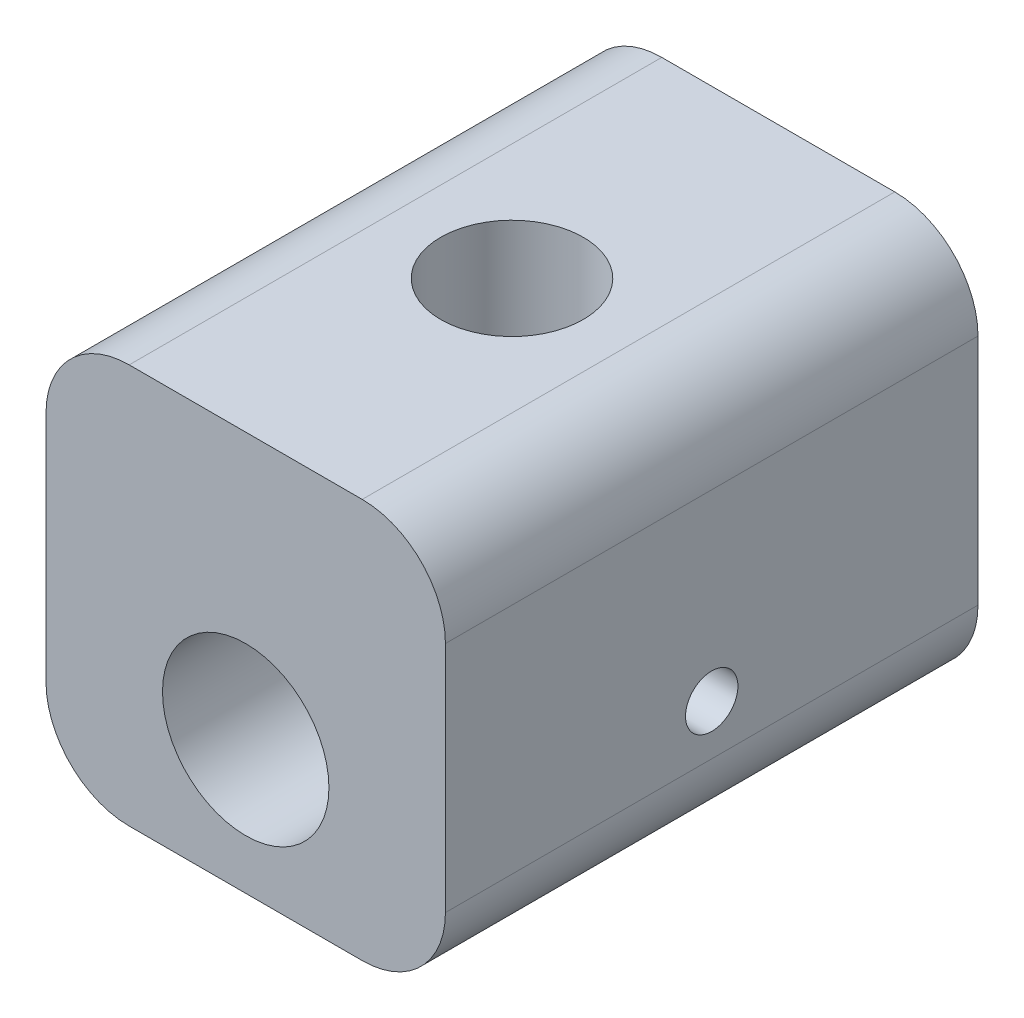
SolidWorks part; units mm, degrees
ref_plane "Front Plane" through (0, 0, 0) normal (0, 0, 1) x (1, 0, 0)
ref_plane "Top Plane" through (0, 0, 0) normal (0, 1, 0) x (1, 0, 0)
ref_plane "Right Plane" through (0, 0, 0) normal (1, 0, 0) x (0, 0, -1)
sketch "Sketch1" plane through (0, 0, 0) normal (0, 0, 1) x (1, 0, 0)
  line L0 (0, -6.35) -> (0, 12.7) construction
  line L5 (-9.525, 12.7) -> (9.525, 12.7)
  line L6 (-9.525, 12.7) -> (-9.525, -6.35)
  line L7 (-9.525, -6.35) -> (9.525, -6.35)
  line L8 (9.525, 12.7) -> (9.525, -6.35)
  circle A0 centre (0, 0) radius 3.9688
  point P9 (0, 0)
  dimension "D1" = 7.9375
  dimension "D2" = 19.05
  dimension "D3" = 6.35
  dimension "D4" = 12.7
extrude "Boss-Extrude1" add sketch "Sketch1" along normal blind 25.4
fillet "Fillet1" radius 3.9688 4 edges at (9.525, -6.35, 12.7) (-9.525, -6.35, 12.7) (-9.525, 12.7, 12.7) (9.525, 12.7, 12.7)
hole_wizard "Tap Drill for M8x1.25 Tap1" positions "Sketch2" profile "Sketch4" hole size "M8x1.25" standard "ANSI Metric"
sketch "Sketch2" plane through (0, 12.7, 0) normal (0, 1, 0) x (1, 0, 0)
  point P0 (0, -12.7)
sketch "Sketch4" plane through (0, 12.7, 12.7) normal (1, 0, 0) x (0, 0, 1)
  line L0 (0, 0) -> (0, 8.7312)
  line L1 (0, 8.7312) -> (3.4, 8.7312)
  line L2 (3.4, 8.7312) -> (3.4, 0)
  line L5 (3.4, 0) -> (0, 0)
  line L11 (0, -6.35) -> (0, 107.95) construction
  dimension "Thru Hole Dia." = 6.8
  dimension "Thru Hole Depth" = 8.7312
hole_wizard "Tap Drill for M3x0.5 Tap1" positions "Sketch5" profile "Sketch6" hole size "M3x0.5" standard "ANSI Metric"
sketch "Sketch5" plane through (9.525, 0, 0) normal (1, 0, 0) x (0, 0, -1)
  point P0 (-12.7, 0)
sketch "Sketch6" plane through (9.525, 0, 12.7) normal (0, 1, 0) x (0, 0, -1)
  line L0 (0, 0) -> (0, 5.5562)
  line L1 (0, 5.5562) -> (1.25, 5.5562)
  line L2 (1.25, 5.5562) -> (1.25, 0)
  line L5 (1.25, 0) -> (0, 0)
  line L11 (0, -6.35) -> (0, 107.95) construction
  dimension "Thru Hole Dia." = 2.5
  dimension "Thru Hole Depth" = 5.5562
